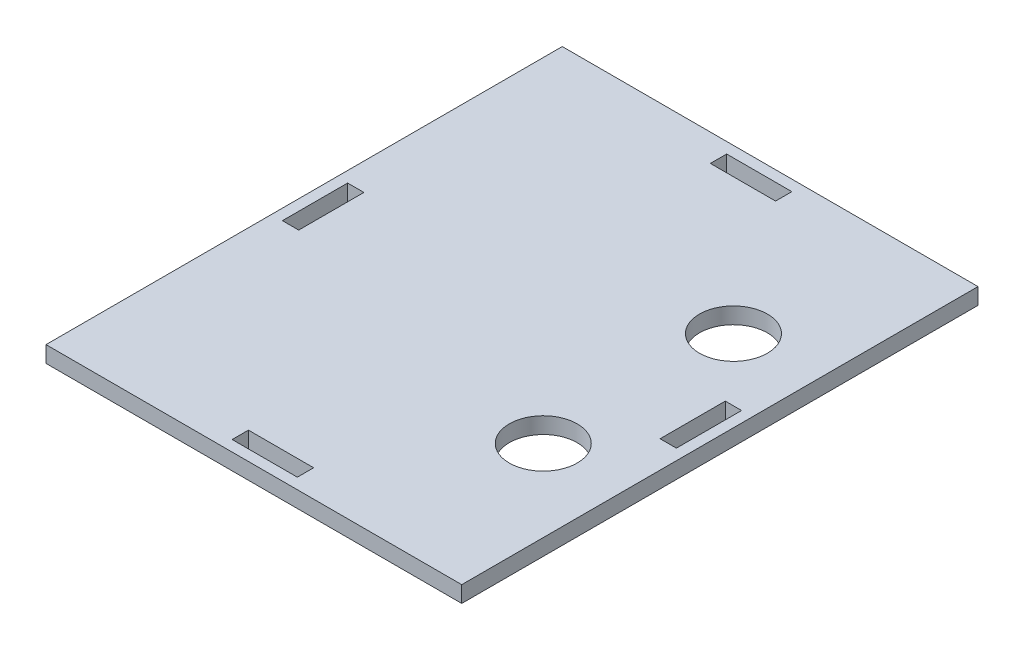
SolidWorks part; units mm, degrees
ref_plane "Front Plane" through (0, 0, 0) normal (0, 0, 1) x (1, 0, 0)
ref_plane "Top Plane" through (0, 0, 0) normal (0, 1, 0) x (1, 0, 0)
ref_plane "Right Plane" through (0, 0, 0) normal (1, 0, 0) x (0, 0, -1)
sketch "Sketch1" plane through (0, 0, 0) normal (0, 1, 0) x (1, 0, 0)
  line L0 (35.5153, 0) -> (-36.25, 0) construction
  line L1 (-36.25, 45.5) -> (36.25, 45.5)
  line L2 (-36.25, 45.5) -> (-36.25, -45.5)
  line L3 (-36.25, -45.5) -> (36.25, -45.5)
  line L4 (36.25, 45.5) -> (36.25, -45.5)
  line L5 (-36.25, 45.5) -> (36.25, -45.5) construction
  line L6 (-36.25, -45.5) -> (36.25, 45.5) construction
  line L7 (-37.7102, 42.5) -> (54.1383, 42.5) construction
  line L8 (0, 45.5) -> (0, -48.3412) construction
  line L9 (6, -45.5) -> (6, -42.5)
  line L10 (-6, 45.5) -> (6, 45.5)
  line L11 (-6, 45.5) -> (-6, 42.5)
  line L12 (-6, 42.5) -> (6, 42.5)
  line L13 (6, 45.5) -> (6, 42.5)
  line L14 (-36.25, 45.5) -> (36.25, 45.5)
  line L15 (-36.25, 45.5) -> (-36.25, 47.5)
  line L16 (-36.25, 47.5) -> (36.25, 47.5)
  line L17 (36.25, 45.5) -> (36.25, 47.5)
  line L18 (-6, -42.5) -> (6, -42.5)
  line L19 (-6, -45.5) -> (-6, -42.5)
  line L20 (-36.25, -45.5) -> (36.25, -45.5)
  line L21 (-36.25, -45.5) -> (-36.25, -47.5)
  line L22 (-36.25, -47.5) -> (36.25, -47.5)
  line L23 (-33.25, 47.5) -> (-33.25, -50.0807) construction
  line L24 (33.25, 6) -> (33.25, -6)
  line L25 (-36.25, 6) -> (-33.25, 6)
  line L26 (-36.25, 6) -> (-36.25, -6)
  line L27 (-36.25, -6) -> (-33.25, -6)
  line L28 (-33.25, 6) -> (-33.25, -6)
  line L29 (-36.25, 45.5) -> (-38.25, 45.5)
  line L30 (-36.25, 45.5) -> (-36.25, -47.5)
  line L31 (-36.25, -47.5) -> (-38.25, -47.5)
  line L32 (-38.25, 45.5) -> (-38.25, -47.5)
  line L33 (36.25, -6) -> (33.25, -6)
  line L34 (36.25, 6) -> (36.25, -6)
  line L35 (36.25, 6) -> (33.25, 6)
  line L36 (38.25, 45.5) -> (38.25, -47.5)
  line L37 (36.25, 47.5) -> (38.25, 47.5)
  line L38 (38.25, 47.5) -> (38.25, 45.5)
  line L39 (36.25, -47.5) -> (38.25, -47.5)
  line L40 (-38.25, 45.5) -> (-38.25, 47.5)
  line L41 (-38.25, 47.5) -> (-36.25, 47.5)
  point P0 (0, 0)
  dimension "D1" = 72.5
  dimension "D2" = 91
  dimension "D3" = 3
  dimension "D4" = 12
  dimension "D5" = 6
  dimension "D6" = 2
  dimension "D7" = 3
  dimension "D8" = 12
  dimension "D9" = 6
  dimension "D10" = 2
extrude "Boss-Extrude2" add sketch "Sketch1" along normal blind 3 contours L35 L4 L1 L13 L12 L11 L2 L25 L28 L27 L3 L19 L18 L9 L33 L24 | L22 L39 L36 L38 L37 L17 L4 L3 L21 | L29 L32 L31 L21 L2 | L1 L17 L16 L15 | L41 L40 L29 L15
sketch "Sketch2" plane through (0, 3, 0) normal (0, 1, 0) x (1, 0, 0)
  line L0 (23.25, 47.5) -> (23.25, -47.5) construction
  line L1 (-38.25, 47.5) -> (38.25, 47.5) construction
  line L2 (-38.25, -47.5) -> (38.25, -47.5) construction
  line L3 (38.25, 47.5) -> (38.25, -47.5) construction
  line L4 (-38.25, 0) -> (38.25, 0) construction
  line L5 (-38.25, 47.5) -> (-38.25, -47.5) construction
  circle A0 centre (23.25, 17.5) radius 6.25
  circle A1 centre (23.25, -17.5) radius 6.25
  dimension "D2" = 12.5
  dimension "D3" = 12.5
  dimension "D1" = 15
  dimension "D4" = 17.5
  dimension "D5" = 17.5
extrude "Cut-Extrude1" cut sketch "Sketch2" against normal blind 3
